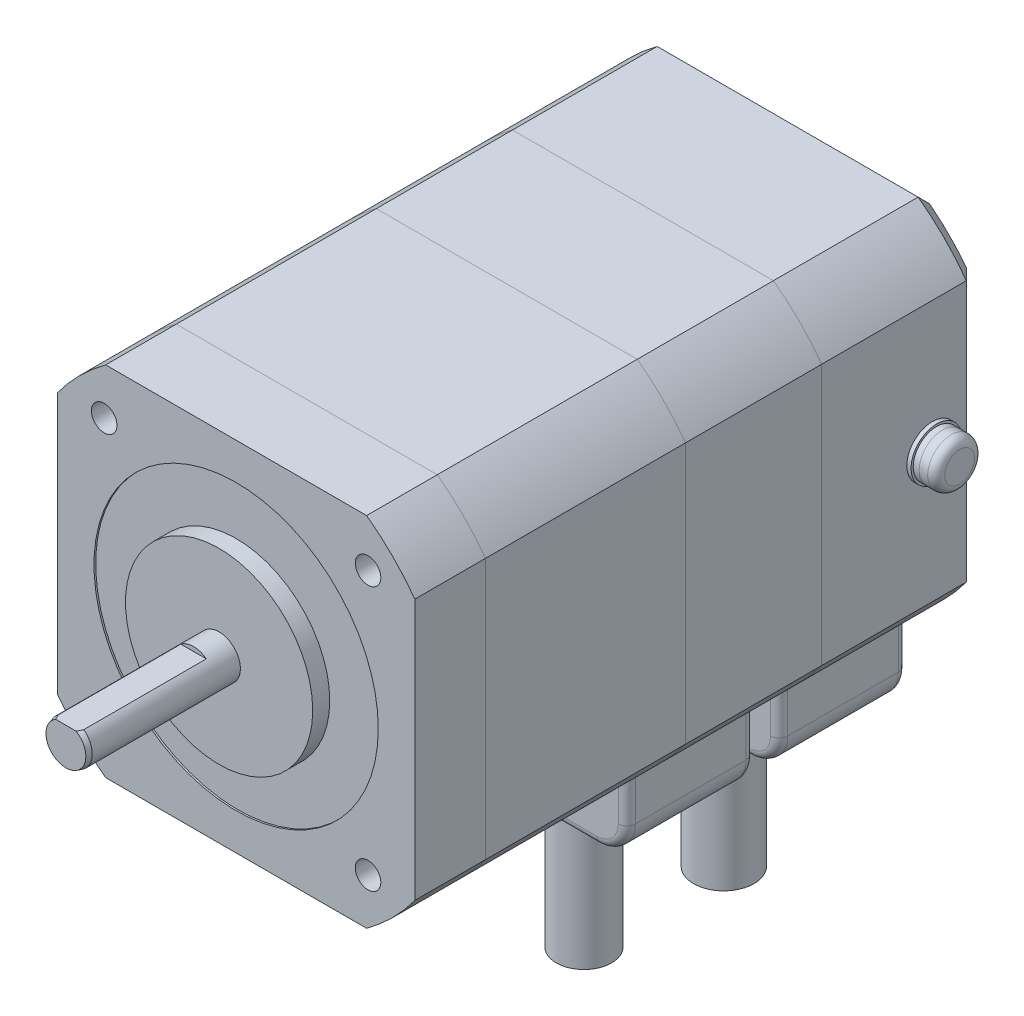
SolidWorks part; units mm, degrees
ref_plane "正面" through (0, 0, 0) normal (0, 0, 1) x (1, 0, 0)
ref_plane "平面" through (0, 0, 0) normal (0, 1, 0) x (1, 0, 0)
ref_plane "右側面" through (0, 0, 0) normal (1, 0, 0) x (0, 0, -1)
sketch "ｽｹｯﾁ1" plane through (0, 0, 0) normal (0, 0, 1) x (1, 0, 0)
  circle A0 centre (0, 0) radius 2.5
  dimension "D1" = 5
extrude "ﾎﾞｽ - 押し出し1" add sketch "ｽｹｯﾁ1" along normal blind 20
sketch "ｽｹｯﾁ2" plane through (0, 0, 0) normal (0, 0, 1) x (1, 0, 0)
  line L1 (-21, -21) -> (21, -21)
  line L2 (-21, -21) -> (-21, 21)
  line L3 (-21, 21) -> (21, 21)
  line L4 (21, -21) -> (21, 21)
  line L5 (-21, -21) -> (21, 21) construction
  line L6 (-21, 21) -> (21, -21) construction
  circle A0 centre (0, 0) radius 26
  point P0 (0, 0)
  dimension "D3" = 52
  dimension "D1" = 42
  dimension "D2" = 42
extrude "ﾎﾞｽ - 押し出し2" add sketch "ｽｹｯﾁ2" against normal blind 8.3 separate body contours L4 A0 L3 L2 L1
sketch "ｽｹｯﾁ3" plane through (0, 0, -8.3) normal (0, 0, -1) x (-1, 0, 0)
  line L4 (-21, 15.3297) -> (-21, -15.3297)
  line L5 (-15.3297, -21) -> (15.3297, -21)
  line L6 (21, -15.3297) -> (21, 15.3297)
  line L7 (15.3297, 21) -> (-15.3297, 21)
  line L8 (-21, 15.3297) -> (-21, -15.3297)
  line L9 (-15.3297, -21) -> (15.3297, -21)
  line L10 (21, -15.3297) -> (21, 15.3297)
  line L11 (15.3297, 21) -> (-15.3297, 21)
  arc A4 (-21, -15.3297) -> (-15.3297, -21) centre (0, 0) ccw
  arc A5 (15.3297, -21) -> (21, -15.3297) centre (0, 0) ccw
  arc A6 (21, 15.3297) -> (15.3297, 21) centre (0, 0) ccw
  arc A7 (-15.3297, 21) -> (-21, 15.3297) centre (0, 0) ccw
  arc A8 (-21, -15.3297) -> (-15.3297, -21) centre (0, 0) ccw
  arc A9 (15.3297, -21) -> (21, -15.3297) centre (0, 0) ccw
  arc A10 (21, 15.3297) -> (15.3297, 21) centre (0, 0) ccw
  arc A11 (-15.3297, 21) -> (-21, 15.3297) centre (0, 0) ccw
  dimension "D1" = 0
extrude "ﾎﾞｽ - 押し出し3" add sketch "ｽｹｯﾁ3" along normal blind 23.5 separate body
sketch "ｽｹｯﾁ4" plane through (0, 0, -31.8) normal (0, 0, -1) x (-1, 0, 0)
  line L4 (-21, 15.3297) -> (-21, -15.3297)
  line L5 (-15.3297, -21) -> (15.3297, -21)
  line L6 (21, -15.3297) -> (21, 15.3297)
  line L7 (15.3297, 21) -> (-15.3297, 21)
  line L8 (-21, 15.3297) -> (-21, -15.3297)
  line L9 (-15.3297, -21) -> (15.3297, -21)
  line L10 (21, -15.3297) -> (21, 15.3297)
  line L11 (15.3297, 21) -> (-15.3297, 21)
  arc A4 (-15.3297, 21) -> (-21, 15.3297) centre (0, 0) ccw
  arc A5 (-21, -15.3297) -> (-15.3297, -21) centre (0, 0) ccw
  arc A6 (15.3297, -21) -> (21, -15.3297) centre (0, 0) ccw
  arc A7 (21, 15.3297) -> (15.3297, 21) centre (0, 0) ccw
  arc A8 (-15.3297, 21) -> (-21, 15.3297) centre (0, 0) ccw
  arc A9 (-21, -15.3297) -> (-15.3297, -21) centre (0, 0) ccw
  arc A10 (15.3297, -21) -> (21, -15.3297) centre (0, 0) ccw
  arc A11 (21, 15.3297) -> (15.3297, 21) centre (0, 0) ccw
  dimension "D1" = 0
extrude "ﾎﾞｽ - 押し出し4" add sketch "ｽｹｯﾁ4" along normal blind 16 separate body
sketch "ｽｹｯﾁ5" plane through (0, 0, -47.8) normal (0, 0, -1) x (-1, 0, 0)
  line L4 (-21, 15.3297) -> (-21, -15.3297)
  line L5 (-15.3297, -21) -> (15.3297, -21)
  line L6 (21, -15.3297) -> (21, 15.3297)
  line L7 (15.3297, 21) -> (-15.3297, 21)
  line L8 (-21, 15.3297) -> (-21, -15.3297)
  line L9 (-15.3297, -21) -> (15.3297, -21)
  line L10 (21, -15.3297) -> (21, 15.3297)
  line L11 (15.3297, 21) -> (-15.3297, 21)
  arc A4 (-15.3297, 21) -> (-21, 15.3297) centre (0, 0) ccw
  arc A5 (-21, -15.3297) -> (-15.3297, -21) centre (0, 0) ccw
  arc A6 (15.3297, -21) -> (21, -15.3297) centre (0, 0) ccw
  arc A7 (21, 15.3297) -> (15.3297, 21) centre (0, 0) ccw
  arc A8 (-15.3297, 21) -> (-21, 15.3297) centre (0, 0) ccw
  arc A9 (-21, -15.3297) -> (-15.3297, -21) centre (0, 0) ccw
  arc A10 (15.3297, -21) -> (21, -15.3297) centre (0, 0) ccw
  arc A11 (21, 15.3297) -> (15.3297, 21) centre (0, 0) ccw
  dimension "D1" = 0
extrude "ﾎﾞｽ - 押し出し5" add sketch "ｽｹｯﾁ5" along normal blind 19 separate body
sketch "ｽｹｯﾁ6" plane through (0, -21, 0) normal (0, -1, 0) x (1, 0, 0)
  line L0 (15.3297, -66.8) -> (-15.3297, -66.8) construction
  line L1 (-14, -31.9) -> (14, -31.9)
  line L2 (-14, -31.9) -> (-14, -46.9)
  line L3 (-14, -46.9) -> (14, -46.9)
  line L4 (14, -31.9) -> (14, -46.9)
  line L5 (21, -47.8) -> (21, -31.8) construction
  dimension "D1" = 19.9
  dimension "D2" = 15
  dimension "D3" = 7
  dimension "D4" = 28
extrude "ﾎﾞｽ - 押し出し6" add sketch "ｽｹｯﾁ6" along normal blind 10 separate body
sketch "ｽｹｯﾁ7" plane through (0, -21, 0) normal (0, -1, 0) x (1, 0, 0)
  line L0 (15.3297, -66.8) -> (-15.3297, -66.8) construction
  line L1 (-14, -49.8) -> (14, -49.8)
  line L2 (-14, -49.8) -> (-14, -64.8)
  line L3 (-14, -64.8) -> (14, -64.8)
  line L4 (14, -49.8) -> (14, -64.8)
  line L5 (21, -66.8) -> (21, -47.8) construction
  dimension "D1" = 2
  dimension "D2" = 15
  dimension "D3" = 7
  dimension "D4" = 28
extrude "ﾎﾞｽ - 押し出し7" add sketch "ｽｹｯﾁ7" along normal blind 10 separate body
chamfer "面取り2" distance 0.6 angle 15 1 edges at (2.5, 0, 20)
sketch "ｽｹｯﾁ8" plane through (0, 0, 20) normal (0, 0, 1) x (1, 0, 0)
  line L1 (-4.4199, 2) -> (5.9601, 2)
  line L2 (-4.4199, 2) -> (-4.4199, 7.8932)
  line L3 (-4.4199, 7.8932) -> (5.9601, 7.8932)
  line L4 (5.9601, 2) -> (5.9601, 7.8932)
  dimension "D1" = 2
extrude "ｶｯﾄ - 押し出し1" cut sketch "ｽｹｯﾁ8" against normal blind 15
sketch "ｽｹｯﾁ9" plane through (0, 0, 0) normal (0, 0, 1) x (1, 0, 0)
  circle A0 centre (0, 0) radius 11
  dimension "D1" = 22
extrude "ﾎﾞｽ - 押し出し8" add sketch "ｽｹｯﾁ9" along normal blind 2
sketch "ｽｹｯﾁ10" plane through (0, 0, 0) normal (0, 0, 1) x (1, 0, 0)
  circle A0 centre (15.5, 15.5) radius 1.5
  circle A1 centre (15.5, -15.5) radius 1.5
  circle A2 centre (-15.5, -15.5) radius 1.5
  circle A3 centre (-15.5, 15.5) radius 1.5
  dimension "D1" = 3
  dimension "D3" = 15.5
  dimension "D5" = 31
  dimension "D6" = 15.5
  dimension "D2" = 15.5
  dimension "D4" = 4
extrude "ｶｯﾄ - 押し出し2" cut sketch "ｽｹｯﾁ10" against normal blind 4.5
fillet "ﾌｨﾚｯﾄ1" radius 3.5 2 edges at (-14, -31, -39.4) (14, -31, -39.4)
fillet "ﾌｨﾚｯﾄ2" radius 3.5 2 edges at (-14, -31, -57.3) (14, -31, -57.3)
sketch "ｽｹｯﾁ11" plane through (21, 0, 0) normal (1, 0, 0) x (0, 0, -1)
  line L0 (66.8, 15.3297) -> (66.8, -15.3297) construction
  line L1 (66.8, 21) -> (47.8, 21) construction
  circle A0 centre (60.8, 0) radius 3
  dimension "D2" = 6
  dimension "D3" = 21
  dimension "D1" = 6
extrude "ﾎﾞｽ - 押し出し9" add sketch "ｽｹｯﾁ11" along normal blind 0.5 separate body
sketch "ｽｹｯﾁ12" plane through (21.5, 0, 0) normal (1, 0, 0) x (0, 0, -1)
  circle A0 centre (60.8, 0) radius 2.75
  dimension "D1" = 5.5
extrude "ﾎﾞｽ - 押し出し10" add sketch "ｽｹｯﾁ12" along normal blind 0.7 separate body
sketch "ｽｹｯﾁ13" plane through (22.2, 0, 0) normal (1, 0, 0) x (0, 0, -1)
  circle A0 centre (60.8, 0) radius 2.75
  dimension "D1" = 5.5
extrude "ﾎﾞｽ - 押し出し11" add sketch "ｽｹｯﾁ13" along normal blind 2 separate body
fillet "ﾌｨﾚｯﾄ3" radius 1 1 edges at (24.2, 2.75, -60.8)
sketch "ｽｹｯﾁ14" plane through (0, -31, 0) normal (0, -1, 0) x (1, 0, 0)
  line L0 (15.3297, -66.8) -> (-15.3297, -66.8) construction
  line L1 (21, -66.8) -> (21, -47.8) construction
  circle A0 centre (0, -57.3) radius 3.55
  dimension "D2" = 7.1
  dimension "D3" = 21
  dimension "D1" = 9.5
extrude "ﾎﾞｽ - 押し出し12" add sketch "ｽｹｯﾁ14" along normal blind 20 separate body
sketch "ｽｹｯﾁ15" plane through (0, -31, 0) normal (0, -1, 0) x (1, 0, 0)
  line L0 (15.3297, -66.8) -> (-15.3297, -66.8) construction
  line L1 (21, -47.8) -> (21, -31.8) construction
  circle A0 centre (0, -40.87) radius 3.25
  dimension "D1" = 6.5
  dimension "D2" = 25.93
  dimension "D3" = 21
extrude "ﾎﾞｽ - 押し出し13" add sketch "ｽｹｯﾁ15" along normal blind 20 separate body
chamfer "面取り1" distance 2 angle 45 8 edges at (0, 21, -66.8) (-18.3848, 18.3848, -66.8) (-21, 0, -66.8) (-18.3848, -18.3848, -66.8) (0, -21, -66.8) (18.3848, -18.3848, -66.8) (21, 0, -66.8) (18.3848, 18.3848, -66.8)
sketch "ｽｹｯﾁ16" plane through (0, 0, 0) normal (0, 0, 1) x (1, 0, 0)
  circle A0 centre (0, 0) radius 16.7
  dimension "D1" = 33.4
extrude "ｶｯﾄ - 押し出し3" cut sketch "ｽｹｯﾁ16" against normal blind 0.2
fillet "ﾌｨﾚｯﾄ4" radius 1 10 edges at (-14, -24.25, -46.9) (-12.9749, -29.9749, -46.9) (14, -24.25, -46.9) (12.9749, -29.9749, -46.9) (14, -24.25, -31.9) (12.9749, -29.9749, -31.9) (-14, -24.25, -31.9) (-12.9749, -29.9749, -31.9) (0, -31, -46.9) (0, -31, -31.9)
fillet "ﾌｨﾚｯﾄ5" radius 1 10 edges at (-14, -24.25, -64.8) (-12.9749, -29.9749, -64.8) (14, -24.25, -64.8) (12.9749, -29.9749, -64.8) (14, -24.25, -49.8) (12.9749, -29.9749, -49.8) (-14, -24.25, -49.8) (-12.9749, -29.9749, -49.8) (0, -31, -64.8) (0, -31, -49.8)
